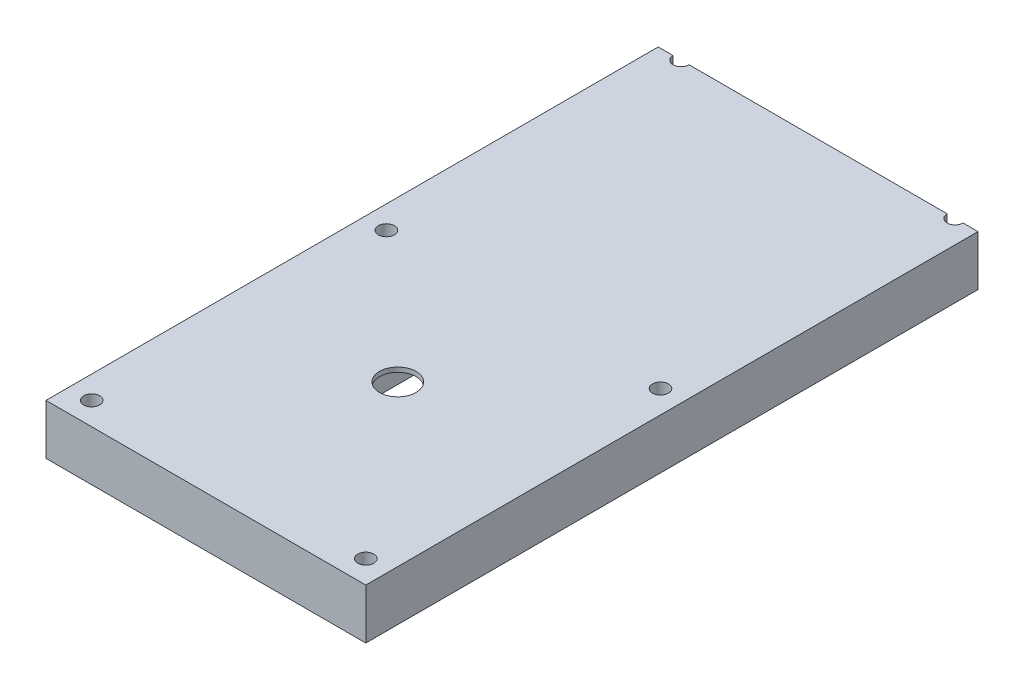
SolidWorks part; units mm, degrees
ref_plane "Спереди" through (0, 0, 0) normal (0, 0, 1) x (1, 0, 0)
ref_plane "Сверху" through (0, 0, 0) normal (0, 1, 0) x (1, 0, 0)
ref_plane "Справа" through (0, 0, 0) normal (1, 0, 0) x (0, 0, -1)
sketch "Эскиз1" plane through (0, 0, 0) normal (0, 1, 0) x (1, 0, 0)
  line L1 (-35, -67) -> (35, -67)
  line L2 (-35, -67) -> (-35, 67)
  line L3 (-35, 67) -> (35, 67)
  line L4 (35, -67) -> (35, 67)
  line L5 (-35, -67) -> (35, 67) construction
  line L6 (-35, 67) -> (35, -67) construction
  point P0 (0, 0)
  dimension "D1" = 134
  dimension "D2" = 70
extrude "Бобышка-Вытянуть1" add sketch "Эскиз1" along normal blind 11
sketch "Эскиз3" plane through (0, 11, 0) normal (0, 1, 0) x (1, 0, 0)
  circle A0 centre (0, -25) radius 2.5 construction
  circle A1 centre (0, 47.5) radius 2.5 construction
  circle A2 centre (0, -25) radius 2.5 construction
  circle A3 centre (0, 47.5) radius 2.5 construction
  circle A4 centre (0, 47.5) radius 3 construction
  circle A5 centre (0, -25) radius 4
  dimension "D1" = 6
  dimension "D2" = 8
extrude "Вырез-Вытянуть1" cut sketch "Эскиз3" against normal blind 10
sketch "Эскиз4" plane through (0, 11, 0) normal (0, 1, 0) x (1, 0, 0)
  circle A0 centre (-30, -62) radius 1.4 construction
  circle A1 centre (30, -62) radius 1.4 construction
  circle A2 centre (-30, 2.5) radius 1.4 construction
  circle A3 centre (30, 2.5) radius 1.4 construction
  circle A4 centre (-30, 67) radius 1.4 construction
  circle A5 centre (30, 67) radius 1.4 construction
  circle A6 centre (-30, -62) radius 1.4 construction
  circle A7 centre (30, -62) radius 1.4 construction
  circle A8 centre (-30, 2.5) radius 1.4 construction
  circle A9 centre (30, 2.5) radius 1.4 construction
  circle A10 centre (-30, 67) radius 1.4 construction
  circle A11 centre (30, 67) radius 1.4 construction
  circle A12 centre (-30, 67) radius 1.75
  circle A13 centre (30, 67) radius 1.75
  circle A14 centre (-30, 2.5) radius 1.75
  circle A15 centre (30, 2.5) radius 1.75
  circle A16 centre (30, -62) radius 1.75
  circle A17 centre (-30, -62) radius 1.75
  dimension "D1" = 3.5
extrude "Вырез-Вытянуть2" cut sketch "Эскиз4" against normal through all
sketch "Эскиз6" plane through (0, 0, 0) normal (0, -1, 0) x (1, 0, 0)
  line L0 (35, -67) -> (31.75, -67) construction
  line L1 (-10.25, -63) -> (10.25, -63)
  line L2 (-10.25, -63) -> (-10.25, -67)
  line L3 (-10.25, -67) -> (10.25, -67)
  line L4 (10.25, -63) -> (10.25, -67)
  line L5 (0, -67) -> (0, -48.8275) construction
  dimension "D1" = 4
  dimension "D2" = 20.5
extrude "Бобышка-Вытянуть3" add sketch "Эскиз6" along normal blind 12.75
sketch "Эскиз7" plane through (0, 0, 0) normal (0, -1, 0) x (1, 0, 0)
  line L1 (10.5, 35) -> (10.5, -72) construction
  line L2 (-10.5, -72) -> (-10.5, 35) construction
  line L3 (-10.5, 35) -> (10.5, 35) construction
  line L4 (-10.5, -63) -> (10.5, -63)
  line L5 (10.5, 35) -> (10.5, -63)
  line L6 (-10.5, -63) -> (-10.5, 35)
  line L7 (-10.5, 35) -> (10.5, 35)
  line L8 (10.25, -63) -> (-10.25, -63) construction
extrude "Вырез-Вытянуть3" cut sketch "Эскиз7" against normal blind 10
